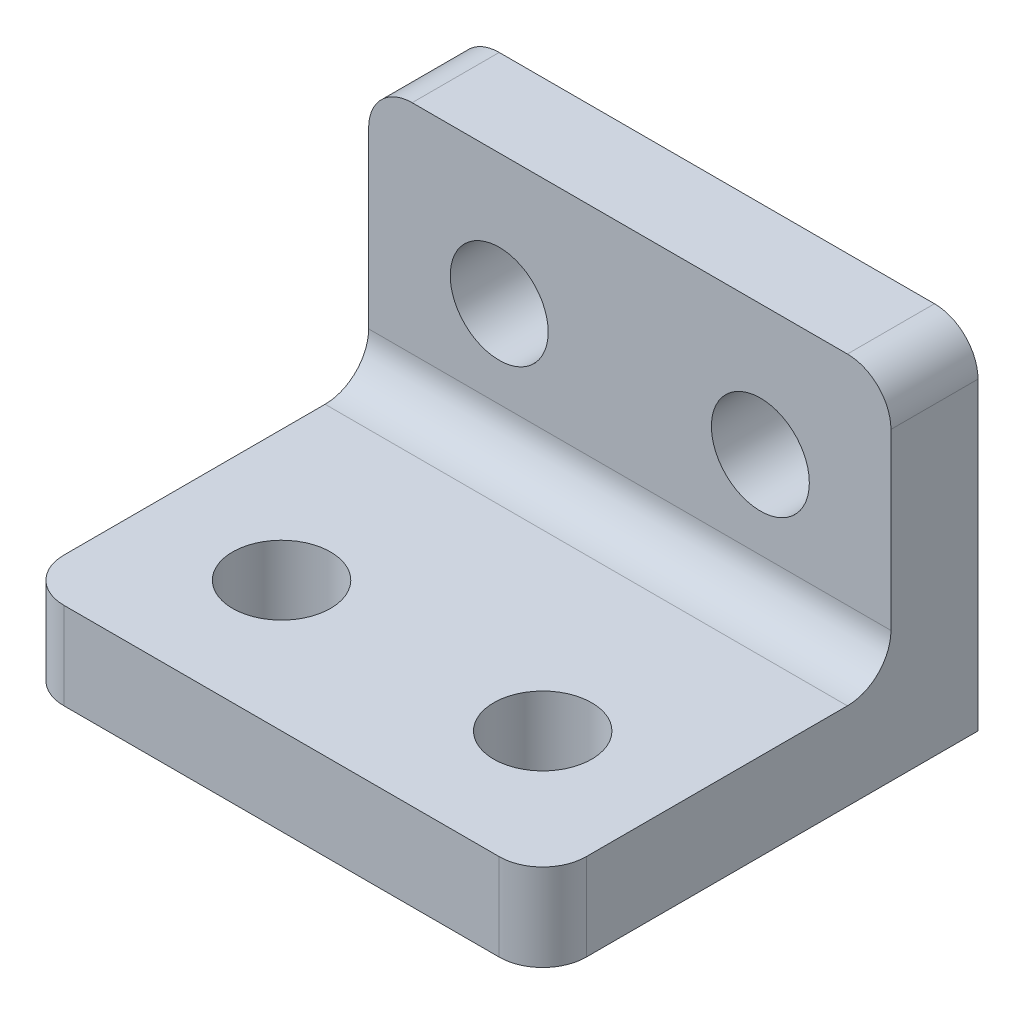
SolidWorks part; units mm, degrees
ref_plane "Front Plane" through (0, 0, 0) normal (0, 0, 1) x (1, 0, 0)
ref_plane "Top Plane" through (0, 0, 0) normal (0, 1, 0) x (1, 0, 0)
ref_plane "Right Plane" through (0, 0, 0) normal (1, 0, 0) x (0, 0, -1)
sketch "Sketch1" plane through (0, 0, 0) normal (0, 0, 1) x (1, 0, 0)
  line L1 (-19.05, -12.7) -> (19.05, -12.7)
  line L2 (-19.05, -12.7) -> (-19.05, 12.7)
  line L3 (-19.05, 12.7) -> (19.05, 12.7)
  line L4 (19.05, -12.7) -> (19.05, 12.7)
  line L5 (-19.05, -12.7) -> (19.05, 12.7) construction
  line L6 (-19.05, 12.7) -> (19.05, -12.7) construction
  circle A0 centre (-9.525, 3.175) radius 3.5719
  circle A1 centre (9.525, 3.175) radius 3.5719
  point P0 (0, 0)
  point P10 (0, 0)
  dimension "D1" = 7.1437
  dimension "D2" = 7.1437
  dimension "D4" = 9.525
  dimension "D5" = 9.525
  dimension "D6" = 15.875
  dimension "D3" = 38.1
  dimension "D7" = 25.4
extrude "Boss-Extrude1" add sketch "Sketch1" along normal blind 6.35
sketch "Sketch2" plane through (0, 0, 6.35) normal (0, 0, 1) x (1, 0, 0)
  line L0 (19.05, -12.7) -> (19.05, 12.7) construction
  line L1 (-19.05, -12.7) -> (19.05, -12.7)
  line L2 (-19.05, -12.7) -> (-19.05, -6.35)
  line L3 (-19.05, -6.35) -> (19.05, -6.35)
  line L4 (19.05, -12.7) -> (19.05, -6.35)
  dimension "D1" = 6.35
extrude "Boss-Extrude2" add sketch "Sketch2" along normal blind 25.4
sketch "Sketch3" plane through (0, -6.35, 0) normal (0, 1, 0) x (1, 0, 0)
  line L0 (19.05, -31.75) -> (19.05, -6.35) construction
  line L1 (-19.05, -31.75) -> (-19.05, -6.35) construction
  line L2 (19.05, -31.75) -> (-19.05, -31.75) construction
  circle A0 centre (-9.525, -22.225) radius 3.5719
  circle A1 centre (9.525, -22.225) radius 3.5719
  point P8 (0, 0)
  dimension "D1" = 7.1437
  dimension "D2" = 7.1437
  dimension "D3" = 9.525
  dimension "D4" = 9.525
  dimension "D5" = 9.525
extrude "Cut-Extrude1" cut sketch "Sketch3" against normal through all
fillet "Fillet1" radius 3.175 5 edges at (19.05, -9.525, 31.75) (-19.05, -9.525, 31.75) (0, -6.35, 6.35) (19.05, 12.7, 3.175) (-19.05, 12.7, 3.175)
